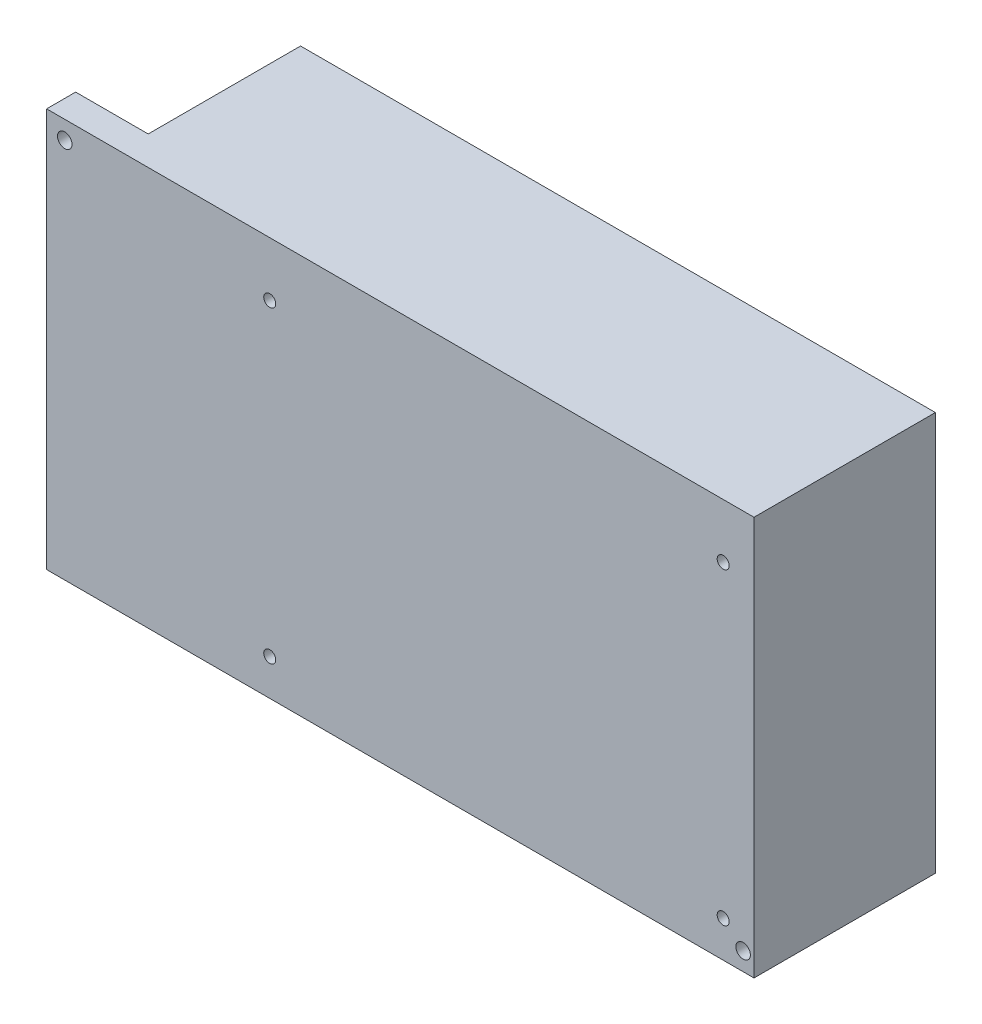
SolidWorks part; units mm, degrees
ref_plane "Płaszczyzna przednia" through (0, 0, 0) normal (0, 0, 1) x (1, 0, 0)
ref_plane "Płaszczyzna górna" through (0, 0, 0) normal (0, 1, 0) x (1, 0, 0)
ref_plane "Płaszczyzna prawa" through (0, 0, 0) normal (1, 0, 0) x (0, 0, -1)
sketch "Szkic1" plane through (0, 0, 0) normal (0, 0, 1) x (1, 0, 0)
  line L1 (0, 0) -> (195, 0)
  line L2 (0, 0) -> (0, 110)
  line L3 (0, 110) -> (195, 110)
  line L4 (195, 0) -> (195, 110)
  dimension "D1" = 110
  dimension "D2" = 195
extrude "Dodanie-wyciągnięcie1" add sketch "Szkic1" along normal blind 50
sketch "Szkic2" plane through (0, 0, 50) normal (0, 0, 1) x (1, 0, 0)
  line L0 (0, 110) -> (0, 0) construction
  line L1 (195, 110) -> (0, 110) construction
  line L2 (0, 0) -> (195, 0) construction
  line L3 (195, 0) -> (195, 110) construction
  circle A0 centre (5, 105) radius 2
  circle A1 centre (192, 5) radius 2
  dimension "D1" = 4
  dimension "D2" = 4
  dimension "D3" = 5
  dimension "D4" = 5
  dimension "D5" = 5
  dimension "D6" = 3
extrude "Wytnij-wyciągnięcie1" cut sketch "Szkic2" against normal blind 10
sketch "Szkic3" plane through (0, 0, 0) normal (-1, 0, 0) x (0, 0, 1)
  line L0 (50, 110) -> (0, 110) construction
  line L1 (42, 110) -> (0, 110)
  line L2 (42, 110) -> (42, 0)
  line L3 (42, 0) -> (0, 0)
  line L4 (0, 110) -> (0, 0)
  line L5 (50, 110) -> (50, 0) construction
  dimension "D1" = 8
extrude "Wytnij-wyciągnięcie2" cut sketch "Szkic3" against normal blind 20
sketch "Szkic4" plane through (0, 0, 50) normal (0, 0, 1) x (1, 0, 0)
  line L0 (186.5, 95) -> (186.5, 10)
  line L2 (195, 0) -> (195, 110) construction
  line L3 (195, 110) -> (0, 110) construction
  line L4 (186.5, 95) -> (61.5, 95)
  line L5 (61.5, 95) -> (61.5, 10)
  dimension "D1" = 8.5
  dimension "D2" = 15
  dimension "D3" = 85
  dimension "D4" = 85
  dimension "D5" = 125
hole_wizard "Otwór gwintowany M41" positions "Szkic5" profile "Szkic6" tap size "M4" standard "DIN"
sketch "Szkic5" plane through (0, 0, 50) normal (0, 0, 1) x (1, 0, 0)
  point P0 (186.5, 10)
  point P3 (186.5, 95)
  point P6 (61.5, 95)
  point P9 (61.5, 10)
sketch "Szkic6" plane through (186.5, 10, 50) normal (1, 0, 0) x (0, -1, 0)
  line L0 (0, 0) -> (0, 11.5)
  line L1 (0, 11.5) -> (1.65, 10.5086)
  line L2 (1.65, 10.5086) -> (1.65, 0)
  line L5 (1.65, 0) -> (0, 0)
  line L10 (0, 11.5) -> (-1.65, 10.5086) construction
  line L11 (0, -6.35) -> (0, 107.95) construction
  dimension "Średnica wiertła gwintu" = 3.3
  dimension "Głębokość otworu gwintowanego" = 11.5
  dimension "Kąt wiertła" = 118
